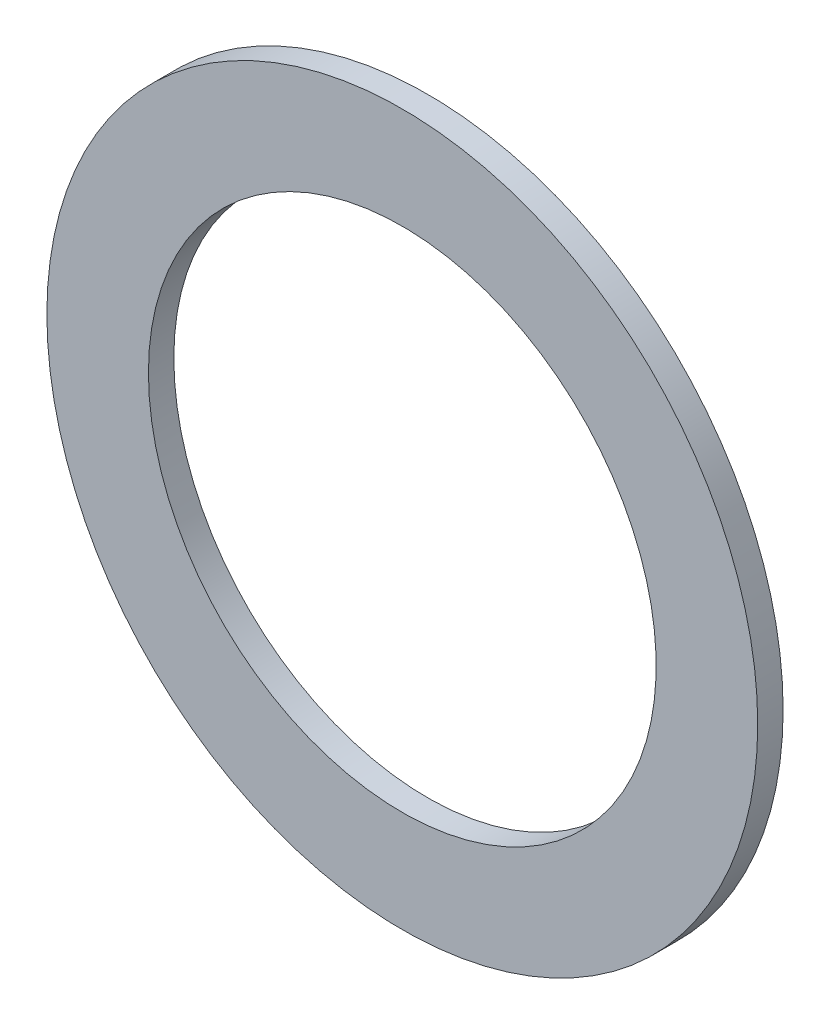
SolidWorks part; units mm, degrees
ref_plane "Face" through (0, 0, 0) normal (0, 0, 1) x (1, 0, 0)
ref_plane "Dessus" through (0, 0, 0) normal (0, 1, 0) x (1, 0, 0)
ref_plane "Droite" through (0, 0, 0) normal (1, 0, 0) x (0, 0, -1)
imported_body "Importée1"
sketch "Esquisse1" plane through (0, 0, 3) normal (0, 0, 1) x (1, 0, 0)
  line L0 (0, 0) -> (0, 100.5367) construction
sketch "Esquisse2" plane through (0, 0, -3) normal (0, 0, 1) x (1, 0, 0)
  line L1 (-134.8482, 164.9199) -> (159.5491, 164.9199)
  line L2 (-134.8482, 164.9199) -> (-134.8482, -140.9303)
  line L3 (-134.8482, -140.9303) -> (159.5491, -140.9303)
  line L4 (159.5491, 164.9199) -> (159.5491, -140.9303)
extrude "Extrusion1" cut sketch "Esquisse2" along normal blind 1
